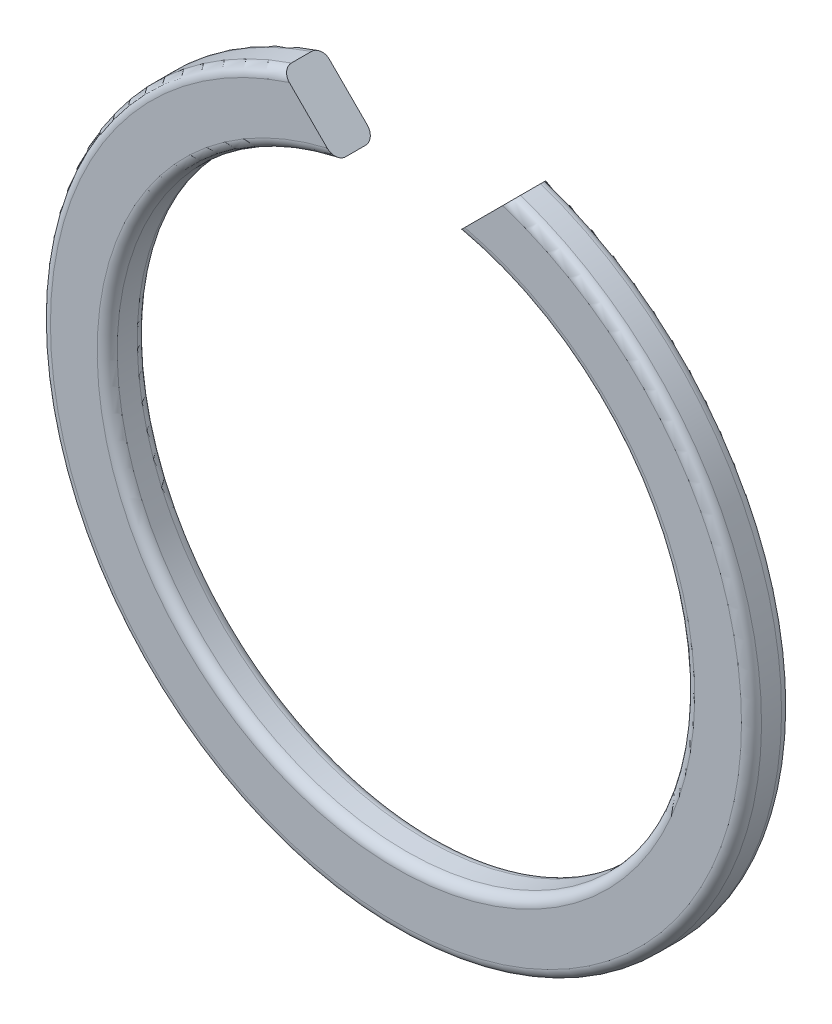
SolidWorks part; units mm, degrees
ref_plane "Front Plane" through (0, 0, 0) normal (0, 0, 1) x (1, 0, 0)
ref_plane "Top Plane" through (0, 0, 0) normal (0, 1, 0) x (1, 0, 0)
ref_plane "Right Plane" through (0, 0, 0) normal (1, 0, 0) x (0, 0, -1)
other "Configuration Table"
sketch "BodySke" plane through (0, 0, 0) normal (0, 0, 1) x (1, 0, 0)
  circle A0 centre (0, 0) radius 10.65
  circle A1 centre (0, 0) radius 8.65
extrude "BaseBody" add sketch "BodySke" along normal blind 1.2
sketch "SlitSke" plane through (0, 0, 0) normal (0, 0, 1) x (1, 0, 0)
  line L0 (0, 0) -> (0, 17.3673) construction
  line L1 (0, 6.65) -> (4, 10.65)
  line L2 (4, 10.65) -> (-4, 10.65)
  line L3 (0, 6.65) -> (-4, 10.65)
  circle A0 centre (0, 0) radius 10.65 construction
  point P9 (0, 9.3328)
extrude "Slit" cut sketch "SlitSke" along normal through all
fillet "Fillet1" radius 0.3 4 edges at (0, -8.65, 0) (0, -10.65, 0) (0, -10.65, 1.2) (0, -8.65, 1.2)
equation "\"D2@SlitSke\" = \"Groove_Diameter@BodySke\" / 2  -  \"Groove_Width@BodySke\" * 2"
